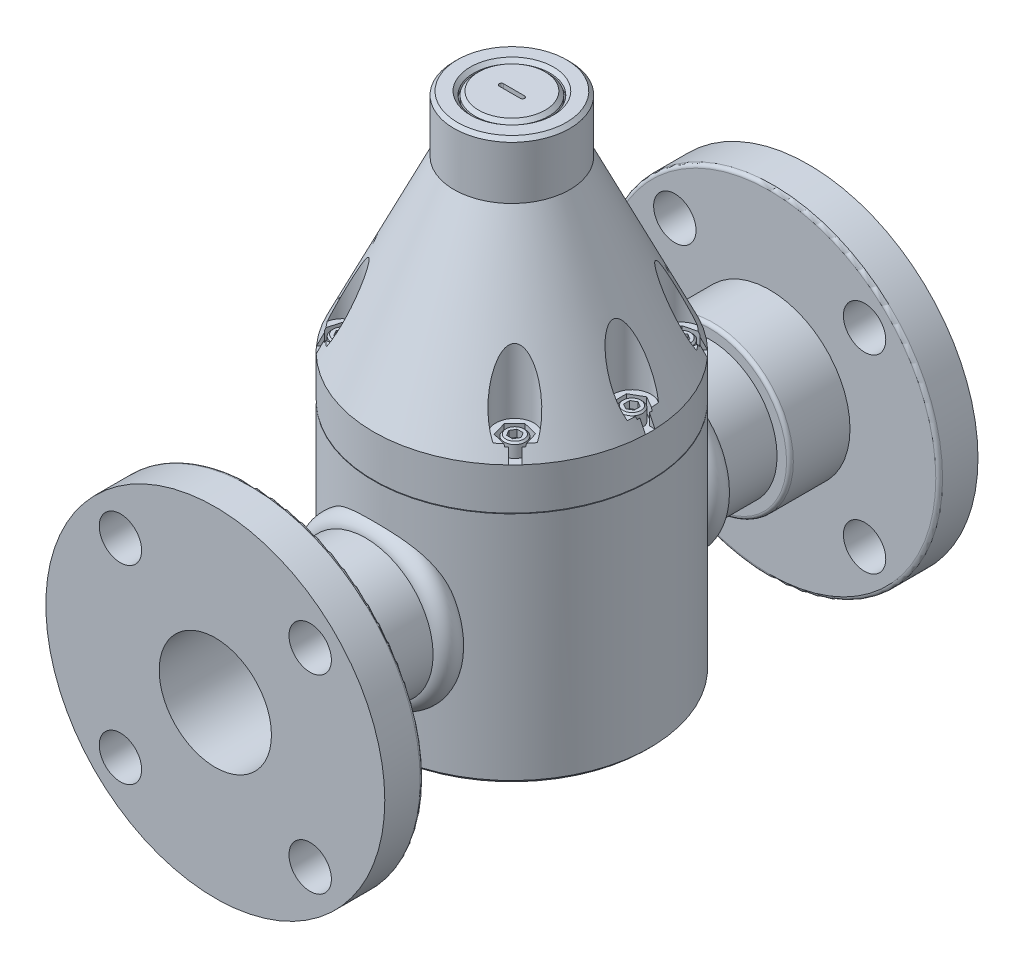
SolidWorks part; units mm, degrees
ref_plane "Front Plane" through (0, 0, 0) normal (0, 0, 1) x (1, 0, 0)
ref_plane "Top Plane" through (0, 0, 0) normal (0, 1, 0) x (1, 0, 0)
ref_plane "Right Plane" through (0, 0, 0) normal (1, 0, 0) x (0, 0, -1)
sketch "Sketch1" plane through (0, 0, 0) normal (0, 1, 0) x (1, 0, 0)
  circle A0 centre (0, 0) radius 62.23
  dimension "D1" = 124.46
extrude "Extrude1" add sketch "Sketch1" along normal blind 226.06
sketch "Sketch2" plane through (0, 0, 0) normal (0, 0, 1) x (1, 0, 0)
  line L0 (-67.5361, 105.41) -> (-45.085, 105.41)
  line L1 (-45.085, 105.41) -> (-45.085, 105.664)
  line L2 (-45.085, 105.664) -> (-62.23, 105.664)
  line L3 (-62.23, 105.664) -> (-62.23, 124.46)
  line L4 (-62.23, 124.46) -> (-26.035, 200.66)
  line L5 (-26.035, 200.66) -> (-26.035, 228.6)
  line L6 (-26.035, 228.6) -> (-77.4616, 228.6)
  line L7 (-77.4616, 228.6) -> (-77.4616, 105.41)
  line L8 (-77.4616, 105.41) -> (-67.5361, 105.41)
  line L9 (0, 0) -> (0, 226.06) construction
  line L10 (62.23, 226.06) -> (-62.23, 226.06) construction
  line L11 (-62.23, 0) -> (62.23, 0) construction
  dimension "D1" = 105.41
  dimension "D2" = 228.6
  dimension "D3" = 45.085
  dimension "D4" = 0.254
  dimension "D5" = 26.035
  dimension "D6" = 62.23
  dimension "D7" = 19.05
  dimension "D8" = 25.4
revolve "Cut-Revolve1" cut sketch "Sketch2" angle 360 about L9
ref_plane "Plane1" through (0, 130.683, 0) normal (0, 1, 0) x (-1, 0, 0)
sketch "Sketch3" plane through (0, 130.683, 0) normal (0, 1, 0) x (-1, 0, 0)
  line L0 (0, 0) -> (-62.23, 0) construction
  line L1 (0, 0) -> (-44.7645, 43.2286) construction
  line L2 (0, 0) -> (-44.7645, -43.2286) construction
  circle A0 centre (0, 0) radius 62.23 construction
  circle A1 centre (0, 0) radius 53.975 construction
  circle A2 centre (-38.8264, 37.4942) radius 8.5725
  circle A3 centre (-53.975, 0) radius 8.5725
  circle A4 centre (-38.8264, -37.4942) radius 8.5725
  dimension "D3" = 17.145
  dimension "D4" = 17.145
  dimension "D5" = 17.145
  dimension "D6" = 107.95
  dimension "D1" = 44
  dimension "D2" = 44
extrude "Extrude2" cut sketch "Sketch3" along normal blind 50.8
sketch "Sketch4" plane through (0, 130.683, 0) normal (0, 1, 0) x (-1, 0, 0)
  line L0 (0, 0) -> (-53.975, 0) construction
  line L1 (-53.975, 0) -> (-53.975, 8.5725) construction
  line L2 (0, 0) -> (-38.8264, 37.4942) construction
  line L3 (-38.8264, 37.4942) -> (-44.7813, 31.3276) construction
  line L4 (0, 0) -> (-38.8264, -37.4942) construction
  line L5 (-38.8264, -37.4942) -> (-44.7813, -31.3276) construction
  line L7 (-43.4105, 32.7472) -> (-37.0074, 31.1507)
  line L8 (-37.0074, 31.1507) -> (-32.4233, 35.8977)
  line L9 (-32.4233, 35.8977) -> (-34.2422, 42.2412)
  line L10 (-34.2422, 42.2412) -> (-40.6453, 43.8377)
  line L11 (-40.6453, 43.8377) -> (-45.2295, 39.0907)
  line L12 (-45.2295, 39.0907) -> (-43.4105, 32.7472)
  line L13 (-53.975, 6.5991) -> (-59.69, 3.2996)
  line L14 (-59.69, 3.2996) -> (-59.69, -3.2996)
  line L15 (-59.69, -3.2996) -> (-53.975, -6.5991)
  line L16 (-53.975, -6.5991) -> (-48.26, -3.2996)
  line L17 (-48.26, -3.2996) -> (-48.26, 3.2996)
  line L18 (-48.26, 3.2996) -> (-53.975, 6.5991)
  line L19 (-43.4105, -32.7472) -> (-45.2295, -39.0907)
  line L20 (-45.2295, -39.0907) -> (-40.6453, -43.8377)
  line L21 (-40.6453, -43.8377) -> (-34.2422, -42.2412)
  line L22 (-34.2422, -42.2412) -> (-32.4233, -35.8977)
  line L23 (-32.4233, -35.8977) -> (-37.0074, -31.1507)
  line L24 (-37.0074, -31.1507) -> (-43.4105, -32.7472)
  arc A0 (-58.8534, -7.049) -> (-58.8534, 7.049) centre (-53.975, 0) ccw construction
  arc A1 (-47.2323, 35.8124) -> (-37.439, 45.9537) centre (-38.8264, 37.4942) ccw construction
  arc A2 (-37.439, -45.9537) -> (-47.2323, -35.8124) centre (-38.8264, -37.4942) ccw construction
  circle A3 centre (-38.8264, 37.4942) radius 5.715 construction
  circle A4 centre (-53.975, 0) radius 5.715 construction
  circle A5 centre (-38.8264, -37.4942) radius 5.715 construction
extrude "Extrude3" cut sketch "Sketch4" against normal blind 6.223
sketch "Sketch5" plane through (0, 130.683, 0) normal (0, 1, 0) x (-1, 0, 0)
  line L0 (0, 0) -> (-44.7645, 43.2286) construction
  line L1 (0, 0) -> (-62.23, 0) construction
  line L2 (0, 0) -> (-44.7645, -43.2286) construction
  line L3 (-39.9479, 41.5433) -> (-44.6727, 46.106)
  line L4 (-43.1488, 38.7022) -> (-47.4921, 42.8965)
  line L5 (-43.1488, 38.7022) -> (-39.9479, 41.5433)
  line L6 (-44.6727, 46.106) -> (-47.4921, 42.8965)
  line L7 (-56.5177, 2.1336) -> (-64.1724, 2.1336)
  line L8 (-56.5177, -2.1336) -> (-64.1724, -2.1336)
  line L9 (-64.1724, -2.1336) -> (-64.1724, 2.1336)
  line L10 (-56.5177, 2.1336) -> (-56.5177, -2.1336)
  line L11 (-41.4493, -37.061) -> (-47.6581, -43.0568)
  line L12 (-38.8718, -40.5042) -> (-44.7525, -46.183)
  line L13 (-41.4493, -37.061) -> (-38.8718, -40.5042)
  line L14 (-44.7525, -46.183) -> (-47.6581, -43.0568)
  circle A0 centre (0, 0) radius 62.23 construction
  dimension "D1" = 44
  dimension "D2" = 44
  dimension "D3" = 2.1336
  dimension "D4" = 2.1336
  dimension "D5" = 2.1336
  dimension "D6" = 2.1336
  dimension "D7" = 2.1336
  dimension "D8" = 2.1336
extrude "Extrude4" cut sketch "Sketch5" against normal blind 6.223
sketch "Sketch6" plane through (0, 130.683, 0) normal (0, 1, 0) x (-1, 0, 0)
  circle A0 centre (-38.8264, 37.4942) radius 4.7625
  circle A1 centre (-53.975, 0) radius 4.7625
  circle A2 centre (-38.8264, -37.4942) radius 4.7625
  dimension "D1" = 9.525
  dimension "D2" = 9.525
  dimension "D3" = 9.525
extrude "Extrude6" add sketch "Sketch6" against normal up to surface (6.223 mm away)
sketch "Sketch7" plane through (0, 130.683, 0) normal (0, 1, 0) x (-1, 0, 0)
  line L1 (-41.5687, 37.4942) -> (-40.1975, 35.1193)
  line L2 (-40.1975, 35.1193) -> (-37.4552, 35.1193)
  line L3 (-37.4552, 35.1193) -> (-36.0841, 37.4942)
  line L4 (-36.0841, 37.4942) -> (-37.4552, 39.8691)
  line L5 (-37.4552, 39.8691) -> (-40.1975, 39.8691)
  line L6 (-40.1975, 39.8691) -> (-41.5687, 37.4942)
  line L7 (-53.975, 2.7423) -> (-56.3499, 1.3711)
  line L8 (-56.3499, 1.3711) -> (-56.3499, -1.3711)
  line L9 (-56.3499, -1.3711) -> (-53.975, -2.7423)
  line L10 (-53.975, -2.7423) -> (-51.6001, -1.3711)
  line L11 (-51.6001, -1.3711) -> (-51.6001, 1.3711)
  line L12 (-51.6001, 1.3711) -> (-53.975, 2.7423)
  line L13 (-38.8264, -34.7519) -> (-41.2013, -36.123)
  line L14 (-41.2013, -36.123) -> (-41.2013, -38.8653)
  line L15 (-41.2013, -38.8653) -> (-38.8264, -40.2365)
  line L16 (-38.8264, -40.2365) -> (-36.4515, -38.8653)
  line L17 (-36.4515, -38.8653) -> (-36.4515, -36.123)
  line L18 (-36.4515, -36.123) -> (-38.8264, -34.7519)
  circle A0 centre (-38.8264, 37.4942) radius 2.3749 construction
  circle A1 centre (-53.975, 0) radius 2.3749 construction
  circle A2 centre (-38.8264, -37.4942) radius 2.3749 construction
extrude "Extrude7" cut sketch "Sketch7" against normal blind 3.175
chamfer "Chamfer1" distance 0.762 angle 45 3 edges at (38.8264, 130.683, -32.7317) (53.975, 130.683, 4.7625) (38.8264, 130.683, 42.2567)
mirror "Mirror1" about plane through (0, 0, 0) normal (1, 0, 0) of "Chamfer1", "Extrude7", "Extrude6", "Extrude4", "Extrude3", "Extrude2"
ref_plane "Plane2" through (0, 226.06, 0) normal (0, 1, 0) x (-1, 0, 0)
sketch "Sketch8" plane through (0, 226.06, 0) normal (0, 1, 0) x (-1, 0, 0)
  circle A0 centre (0, 0) radius 17.145
  dimension "D1" = 34.29
extrude "Extrude8" cut sketch "Sketch8" against normal blind 3.175
sketch "Sketch9" plane through (0, 226.06, 0) normal (0, 1, 0) x (-1, 0, 0)
  circle A0 centre (0, 0) radius 16.51
  dimension "D1" = 33.02
extrude "Extrude9" add sketch "Sketch9" against normal up to surface (3.175 mm away)
sketch "Sketch10" plane through (0, 226.06, 0) normal (0, 1, 0) x (-1, 0, 0)
  line L0 (4.7625, 0) -> (-4.7625, 0) construction
  line L1 (-4.7625, 0.9652) -> (4.7625, 0.9652)
  line L2 (4.7625, -0.9652) -> (-4.7625, -0.9652)
  arc A0 (-4.7625, 0.9652) -> (-4.7625, -0.9652) centre (-4.7625, 0) ccw
  arc A1 (4.7625, -0.9652) -> (4.7625, 0.9652) centre (4.7625, 0) ccw
  dimension "D1" = 4.7625
  dimension "D2" = 9.525
  dimension "D3" = 0.9652
  dimension "D4" = 0.9652
extrude "Extrude10" cut sketch "Sketch10" against normal blind 3.175
chamfer "Chamfer2" distance 1.5748 angle 45 2 edges at (0, 226.06, 17.145) (0, 226.06, 26.035)
chamfer "Chamfer3" distance 1.5748 angle 45 1 edges at (0, 226.06, 16.51)
chamfer "Chamfer4" distance 1.5748 angle 45 1 edges at (0, 0, 62.23)
ref_plane "Plane3" through (0, 0, 133.35) normal (0, 0, 1) x (1, 0, 0)
ref_plane "Plane4" through (0, 0, -133.35) normal (0, 0, 1) x (1, 0, 0)
sketch "Sketch11" plane through (0, 0, 133.35) normal (0, 0, 1) x (1, 0, 0)
  line L0 (0, 0) -> (0, 226.06) construction
  line L1 (24.4602, 226.06) -> (-24.4602, 226.06) construction
  line L2 (62.23, 54.61) -> (-62.23, 54.61) construction
  line L3 (62.23, 1.5748) -> (62.23, 105.41) construction
  line L4 (-62.23, 105.41) -> (-62.23, 1.5748) construction
  line L5 (-60.6552, 0) -> (60.6552, 0) construction
  circle A0 centre (0, 54.61) radius 76.2
  dimension "D2" = 152.4
  dimension "D1" = 54.61
extrude "Boss-Extrude1" add sketch "Sketch11" against normal blind 17.4498 separate body
sketch "Sketch12" plane through (0, 0, -133.35) normal (0, 0, 1) x (1, 0, 0)
  circle A0 centre (0, 54.61) radius 76.2
extrude "Boss-Extrude2" add sketch "Sketch12" along normal blind 17.4498 separate body
sketch "Sketch13" plane through (0, 0, 133.35) normal (0, 0, 1) x (1, 0, 0)
  circle A0 centre (0, 54.61) radius 36.1061
  dimension "D1" = 72.2122
extrude "Boss-Extrude3" add sketch "Sketch13" against normal blind 44.45
sketch "Sketch14" plane through (0, 0, -133.35) normal (0, 0, 1) x (1, 0, 0)
  circle A0 centre (0, 54.61) radius 36.1061
extrude "Boss-Extrude4" add sketch "Sketch14" along normal blind 44.45
sketch "Sketch15" plane through (0, 0, 133.35) normal (0, 0, 1) x (1, 0, 0)
  circle A0 centre (0, 54.61) radius 30.3149
  dimension "D1" = 60.6298
extrude "Boss-Extrude5" add sketch "Sketch15" against normal up to surface (79.0032 mm away)
sketch "Sketch16" plane through (0, 0, 133.35) normal (0, 0, 1) x (1, 0, 0)
  circle A0 centre (0, 54.61) radius 25.2349
  dimension "D1" = 50.4698
extrude "Cut-Extrude1" cut sketch "Sketch16" against normal blind 76.2
sketch "Sketch17" plane through (0, 0, -133.35) normal (0, 0, 1) x (1, 0, 0)
  circle A0 centre (0, 54.61) radius 30.3149
extrude "Boss-Extrude6" add sketch "Sketch17" along normal up to surface (79.0031 mm away)
sketch "Sketch18" plane through (0, 0, -133.35) normal (0, 0, 1) x (1, 0, 0)
  circle A0 centre (0, 54.61) radius 25.2349
extrude "Cut-Extrude2" cut sketch "Sketch18" along normal blind 76.2
fillet "Fillet1" radius 1.524 4 edges at (76.2, 54.61, -115.9002) (36.1061, 54.61, -88.9) (36.1061, 54.61, 88.9) (76.2, 54.61, 115.9002)
sketch "Sketch19" plane through (0, 0, 133.35) normal (0, 0, 1) x (1, 0, 0)
  line L0 (0, 54.61) -> (-76.2, 54.61) construction
  line L1 (0, 54.61) -> (-53.8815, 108.4915) construction
  circle A0 centre (0, 54.61) radius 76.2 construction
  circle A1 centre (0, 54.61) radius 60.325 construction
  circle A2 centre (-42.6562, 97.2662) radius 9.525
  dimension "D2" = 120.65
  dimension "D3" = 19.05
  dimension "D1" = 45
extrude "Cut-Extrude3" cut sketch "Sketch19" against normal blind 25.4
pattern_circular "CirPattern1" count 4 over 360 about axis through (0, 54.61, 0) along (0, 0, 1) of "Cut-Extrude3"
sketch "Sketch20" plane through (0, 0, -133.35) normal (0, 0, 1) x (1, 0, 0)
  circle A0 centre (42.6562, 97.2662) radius 9.525
extrude "Cut-Extrude4" cut sketch "Sketch20" along normal blind 25.4
pattern_circular "CirPattern2" count 4 over 360 about axis through (0, 54.61, 0) along (0, 0, 1) of "Cut-Extrude4"
sketch "Sketch21" plane through (0, 0, 0) normal (1, 0, 0) x (0, 0, -1)
  line L0 (-88.9, 54.61) -> (0, 54.61) construction
  line L1 (-88.9, 20.0279) -> (-88.9, 89.1921) construction
  line L2 (-65.8101, 81.444) -> (-65.8101, 84.1206)
  line L3 (-65.8101, 81.444) -> (-53.867, 81.444)
  line L4 (-53.867, 82.7823) -> (-53.867, 81.444)
  arc A0 (-65.8101, 84.1206) -> (-53.867, 82.7823) centre (-59.7636, 84.1206) cw
revolve "Revolve1" add sketch "Sketch21" angle 360 about L0
mirror "Mirror2" about plane through (0, 0, 0) normal (0, 0, 1) of "Revolve1"
